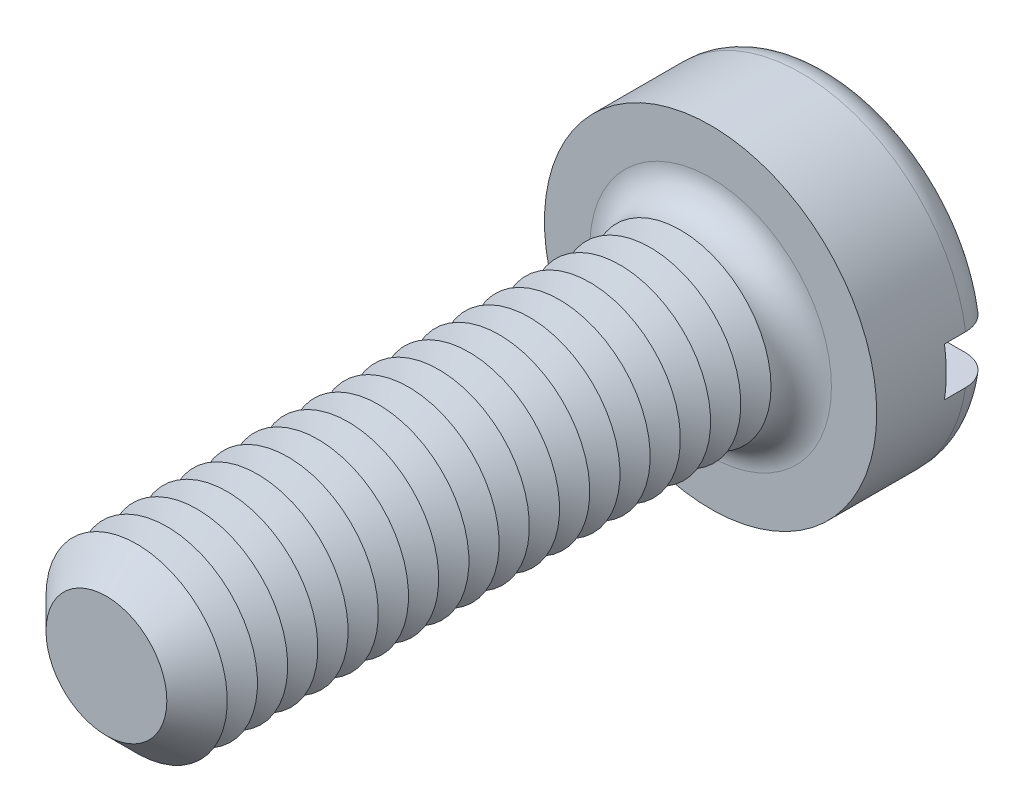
SolidWorks part; units mm, degrees
ref_plane "Front Plane" through (0, 0, 0) normal (0, 0, 1) x (1, 0, 0)
ref_plane "Top Plane" through (0, 0, 0) normal (0, 1, 0) x (1, 0, 0)
ref_plane "Right Plane" through (0, 0, 0) normal (1, 0, 0) x (0, 0, -1)
sketch "Sketch3" plane through (0, 0, 0) normal (0, 0, 1) x (1, 0, 0)
  circle A0 centre (0, 0) radius 2.75
  dimension "D1" = 5.5
extrude "Boss-Extrude2" add sketch "Sketch3" against normal blind 2
sketch "Sketch4" plane through (0, 0, 0) normal (0, 0, 1) x (1, 0, 0)
  circle A0 centre (0, 0) radius 1.5
  dimension "D1" = 3
extrude "Boss-Extrude3" add sketch "Sketch4" along normal blind 10
fillet "Fillet1" radius 0.5 2 edges at (2.75, 0, -2) (1.5, 0, 0)
chamfer "Chamfer1" distance 0.5 angle 45 1 edges at (1.5, 0, 10)
sketch "Sketch5" plane through (0, 0, 0) normal (1, 0, 0) x (0, 0, -1)
  line L0 (1.6944, 0) -> (-7.6738, 0) construction
sketch "Sketch6" plane through (0, 0, 0) normal (1, 0, 0) x (0, 0, -1)
  line L0 (-0.5, 1.5) -> (-0.75, 1.067)
  line L1 (-0.75, 1.067) -> (-1, 1.5)
  line L2 (-0.5, 1.5) -> (-9.5, 1.5) construction
  line L3 (-1, 1.5) -> (-0.5, 1.5)
  dimension "D1" = 0.5
revolve "Cut-Revolve1" cut sketch "Sketch6" angle 360 about L0
pattern_linear "LPattern1" count 18 spacing 0.5 along (0, 0, 1) of "Cut-Revolve1"
sketch "Sketch8" plane through (0, 0, -2) normal (0, 0, -1) x (-1, 0, 0)
  line L1 (2.75, -0.4) -> (-2.75, -0.4)
  line L2 (2.75, -0.4) -> (2.75, 0.4)
  line L3 (2.75, 0.4) -> (-2.75, 0.4)
  line L4 (-2.75, -0.4) -> (-2.75, 0.4)
  line L5 (2.75, -0.4) -> (-2.75, 0.4) construction
  line L6 (2.75, 0.4) -> (-2.75, -0.4) construction
  point P0 (0, 0)
  dimension "D1" = 5.5
  dimension "D2" = 0.8
extrude "Cut-Extrude1" cut sketch "Sketch8" against normal blind 0.85
